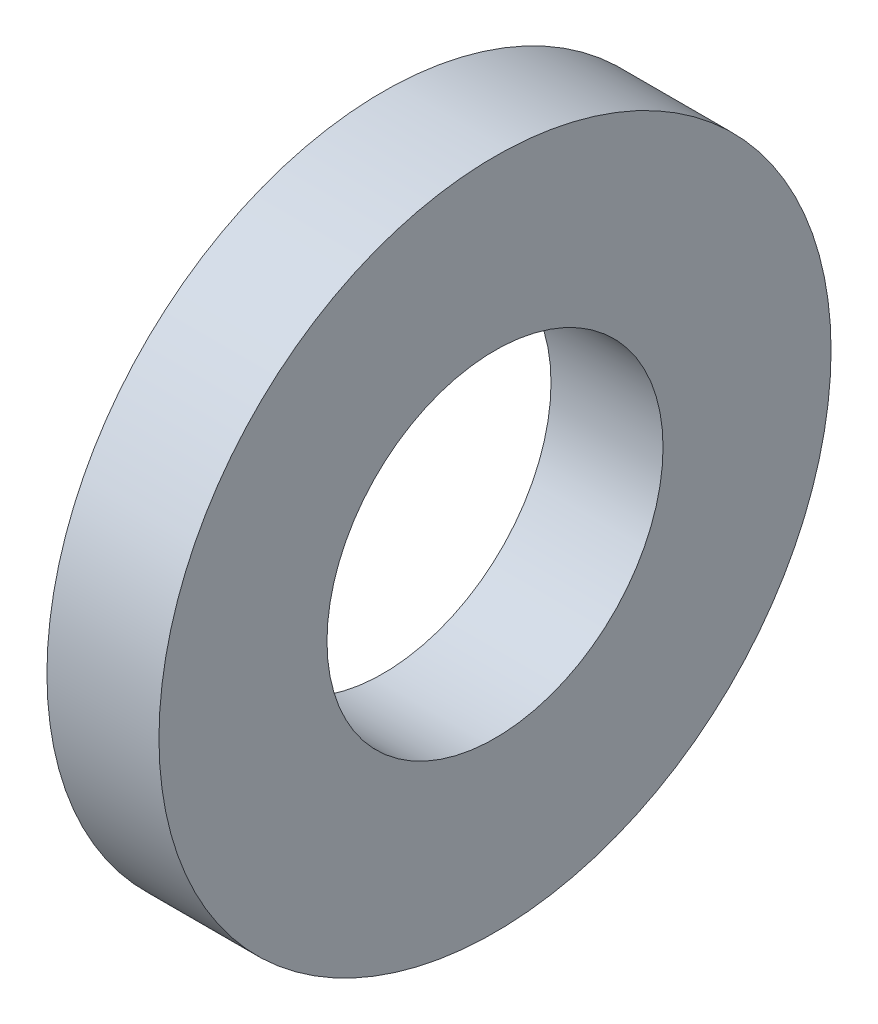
SolidWorks part; units mm, degrees
ref_plane "Front Plane" through (0, 0, 0) normal (0, 0, 1) x (1, 0, 0)
ref_plane "Top Plane" through (0, 0, 0) normal (0, 1, 0) x (1, 0, 0)
ref_plane "Right Plane" through (0, 0, 0) normal (1, 0, 0) x (0, 0, -1)
sketch "Sketch1" plane through (0, 0, 0) normal (1, 0, 0) x (0, 0, -1)
  circle A0 centre (0, 0) radius 13.4874
  circle A1 centre (0, 0) radius 6.7437
  dimension "OD" = 26.9748
  dimension "ID" = 13.4874
extrude "Boss-Extrude1" add sketch "Sketch1" along normal blind 4.4958
